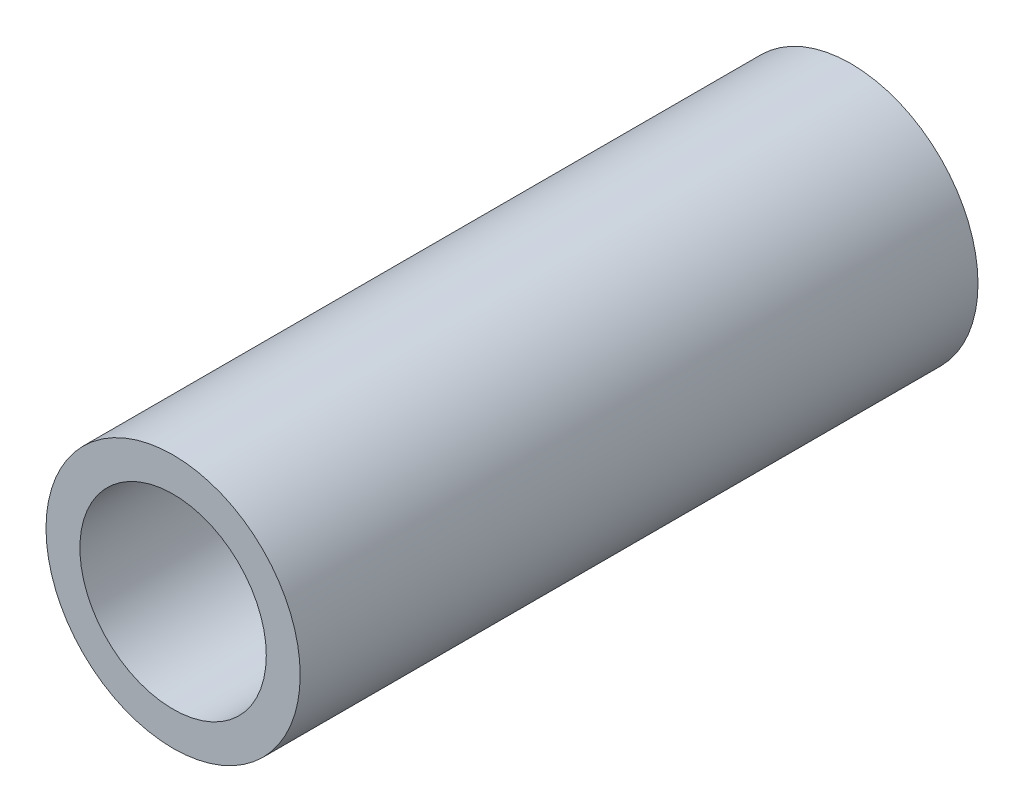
SolidWorks part; units mm, degrees
ref_plane "Front Plane" through (0, 0, 0) normal (0, 0, 1) x (1, 0, 0)
ref_plane "Top Plane" through (0, 0, 0) normal (0, 1, 0) x (1, 0, 0)
ref_plane "Right Plane" through (0, 0, 0) normal (1, 0, 0) x (0, 0, -1)
sketch "Sketch1" plane through (0, 0, 0) normal (0, 0, 1) x (1, 0, 0)
  circle A1 centre (-120.65, 61698.307) radius 9.525
  circle A2 centre (-120.65, 61698.307) radius 6.985
  dimension "D1" = 2.54
extrude "Boss-Extrude1" add sketch "Sketch1" along a picked direction on the side of the normal blind 50.8 contours A1 A2
